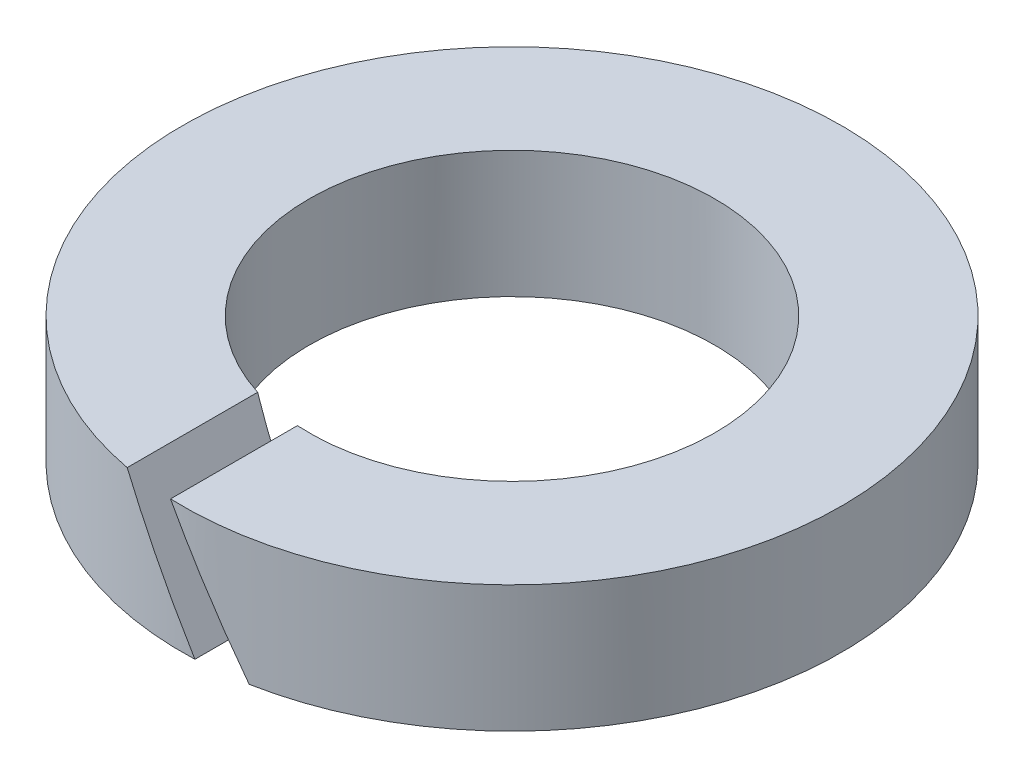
SolidWorks part; units mm, degrees
ref_plane "Base 1" through (0, 0, 0) normal (0, 0, 1) x (1, 0, 0)
ref_plane "Face" through (0, 0, 0) normal (0, 1, 0) x (1, 0, 0)
ref_plane "Base 2" through (0, 0, 0) normal (1, 0, 0) x (0, 0, -1)
sketch "section" plane through (0, 0, 0) normal (0, 0, 1) x (1, 0, 0)
  line L0 (3.2, 1) -> (5.2, 1)
  line L1 (3.2, 1) -> (3.2, -1)
  line L2 (5.2, -1) -> (3.2, -1)
  line L3 (5.2, -1) -> (5.2, 1)
  line L4 (0, 80) -> (0, -70) construction
  line L5 (5.2, 0) -> (3.2, 0) construction
  line L6 (50, 0) -> (-50, 0) construction
  dimension "A" = 6.4
  dimension "B" = 10.4
  dimension "C" = 2
revolve "Révolution" add sketch "section" angle 360 about L4
sketch "Sketch2" plane through (0, 0.6, 0) normal (0, 0, -1) x (-1, 0, 0)
  line L0 (1.4577, 1.9249) -> (-1.4577, -3.1249) construction
  line L1 (0, 49.4) -> (0, -50.6) construction
  line L2 (-0.9623, -1.6) -> (0.1925, 0.4)
  line L3 (-0.1925, -1.6) -> (0.9623, 0.4)
  line L4 (0.9623, 0.4) -> (0.1925, 0.4)
  line L5 (-0.1925, -1.6) -> (-0.9623, -1.6)
  line L6 (-5.2, -1.6) -> (5.2, -1.6) construction
  line L7 (-5.2, 0.4) -> (5.2, 0.4) construction
  dimension "D1" = 30
  dimension "K1" = 0.6667
extrude "fente" cut sketch "Sketch2" against normal up to next
equation "\"K1@Sketch2\" = \"C@section\" / 3"
